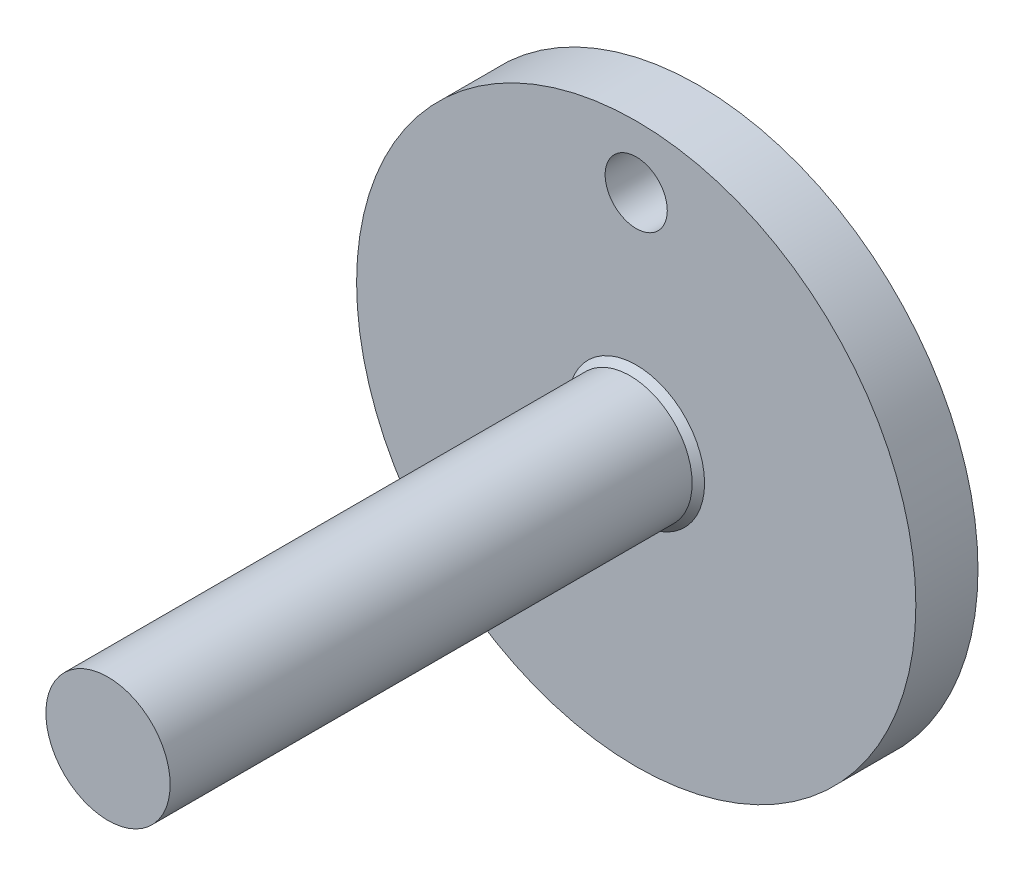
SolidWorks part; units mm, degrees
ref_plane "Front Plane" through (0, 0, 0) normal (0, 0, 1) x (1, 0, 0)
ref_plane "Top Plane" through (0, 0, 0) normal (0, 1, 0) x (1, 0, 0)
ref_plane "Right Plane" through (0, 0, 0) normal (1, 0, 0) x (0, 0, -1)
sketch "Sketch1" plane through (0, 0, 0) normal (0, 0, 1) x (1, 0, 0)
  circle A0 centre (0, 0) radius 45
  circle A1 centre (0, 35) radius 5
  point P5 (0, 0)
  dimension "D1" = 90
  dimension "D2" = 10
  dimension "D3" = 35
extrude "Boss-Extrude1" add sketch "Sketch1" along normal blind 10
sketch "Sketch2" plane through (0, 0, 10) normal (0, 0, 1) x (1, 0, 0)
  circle A0 centre (0, 0) radius 10
  dimension "D1" = 20
extrude "Boss-Extrude2" add sketch "Sketch2" along normal blind 85
chamfer "Chamfer1" distance 1 angle 45 1 edges at (10, 0, 10)
